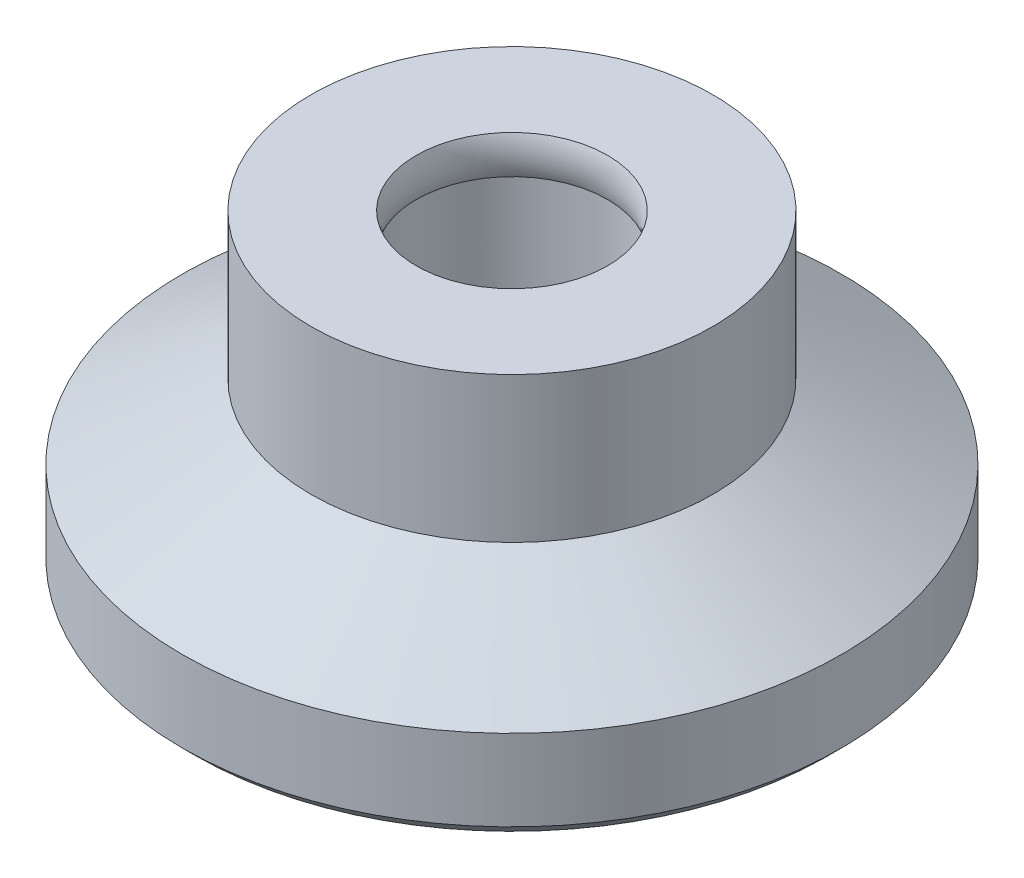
SolidWorks part; units mm, degrees
ref_plane "Front Plane" through (0, 0, 0) normal (0, 0, 1) x (1, 0, 0)
ref_plane "Top Plane" through (0, 0, 0) normal (0, 1, 0) x (1, 0, 0)
ref_plane "Right Plane" through (0, 0, 0) normal (1, 0, 0) x (0, 0, -1)
sketch "Sketch1" plane through (0, 0, 0) normal (0, 1, 0) x (1, 0, 0)
  circle A0 centre (0, 0) radius 6.4
  dimension "D1" = 12.8
extrude "Extrude1" add sketch "Sketch1" along normal mid plane 10
sketch "Sketch3" plane through (0, -5, 0) normal (0, -1, 0) x (1, 0, 0)
  circle A0 centre (0, 0) radius 10.5
  dimension "D1" = 21
extrude "Extrude2" add sketch "Sketch3" against normal blind 3
sketch "Sketch4" plane through (0, 0, 0) normal (0, 0, 1) x (1, 0, 0)
  line L0 (-10.5, -2) -> (-6.4, 0.3671)
  line L1 (-6.4, 5) -> (-6.4, -2) construction
  line L2 (-6.4, 0.3671) -> (-6.4, -2)
  line L3 (-6.4, -2) -> (-10.5, -2)
  dimension "D1" = 30
revolve "Revolve1" add sketch "Sketch4" angle 360 about axis through (0, 5, 0) along (0, -1, 0)
chamfer "Chamfer1" distance 0.42 angle 45 1 edges at (0, -5, -10.5)
sketch "Sketch5" plane through (0, 0, 0) normal (0, 0, 1) x (1, 0, 0)
  line L1 (0, 0) -> (0, 11.3083) construction
  line L2 (0, 5) -> (3.05, 5)
  line L3 (6.4, 5) -> (-6.4, 5) construction
  line L4 (3.05, 3.78) -> (3.05, -0.2391)
  line L5 (3.05, -0.2391) -> (0, -2)
  line L6 (0, -2) -> (0, 5)
  line L7 (10.5, -2) -> (-10.5, -2) construction
  arc A0 (3.05, 5) -> (3.05, 3.78) centre (4.514, 4.39) ccw
  point P14 (2.928, 4.39)
  dimension "D2" = 6.1
  dimension "D1" = 60
  dimension "D3" = 1.22
  dimension "D4" = 0.122
revolve "Cut-Revolve1" cut sketch "Sketch5" angle 360 about L1
equation "\"D3@Sketch5\" = \"D2@Sketch5\"*0.2"
equation "\"D4@Sketch5\" = \"D3@Sketch5\"*0.1"
